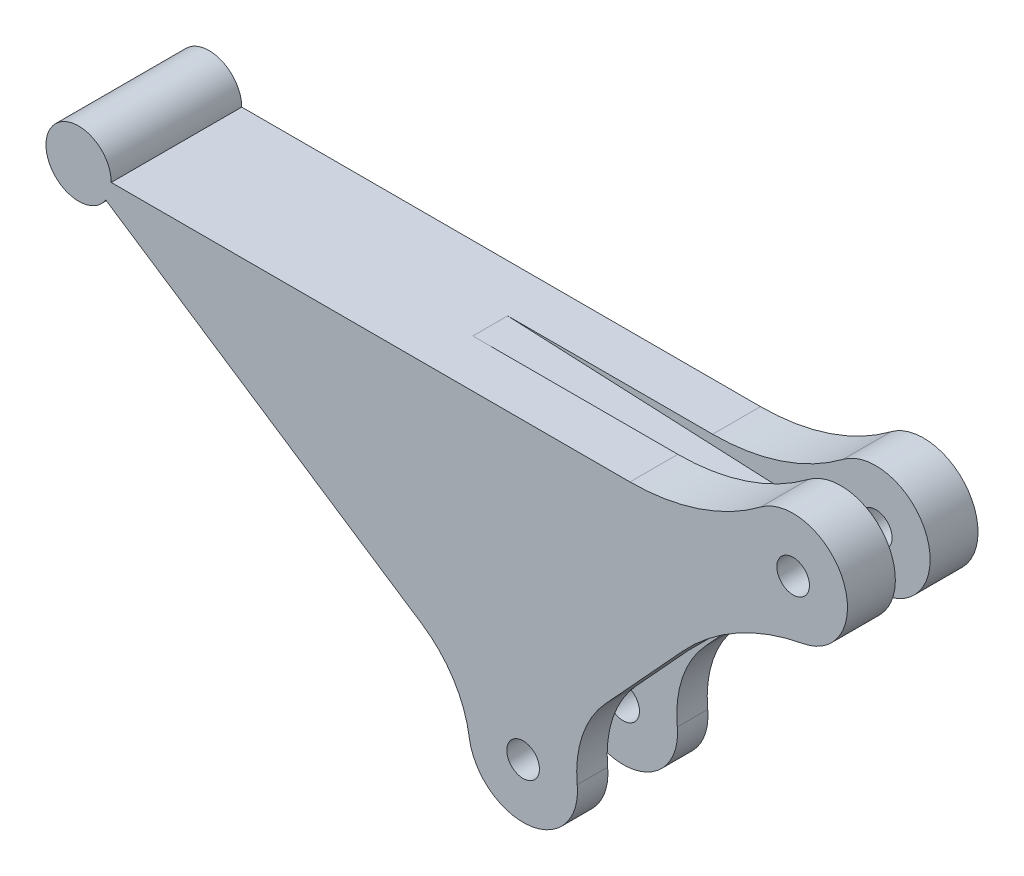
SolidWorks part; units mm, degrees
ref_plane "Plan de face" through (0, 0, 0) normal (0, 0, 1) x (1, 0, 0)
ref_plane "Plan de dessus" through (0, 0, 0) normal (0, 1, 0) x (1, 0, 0)
ref_plane "Plan de droite" through (0, 0, 0) normal (1, 0, 0) x (0, 0, -1)
sketch "Esquisse1" plane through (0, 0, 0) normal (0, 0, 1) x (1, 0, 0)
  line L0 (0, 0) -> (-65.7, 0)
  line L1 (0, 0) -> (-24.8279, -27.0272)
  line L2 (-24.8279, -27.0272) -> (-65.7, 0)
  circle A0 centre (0, 0) radius 1.5
  circle A1 centre (0, 0) radius 5
  circle A2 centre (-65.7, 0) radius 3
  circle A3 centre (0, 0) radius 36.7 construction
  circle A4 centre (-65.7, 0) radius 49 construction
  circle A5 centre (-24.8279, -27.0272) radius 5
  circle A6 centre (-24.8279, -27.0272) radius 1.5
  dimension "D1" = 3
  dimension "D2" = 10
  dimension "D4" = 6
  dimension "D5" = 73.4
  dimension "D6" = 98
  dimension "D7" = 10
  dimension "D8" = 3
  dimension "D3" = 65.7
extrude "Boss.-Extru.1" add sketch "Esquisse1" along normal blind 12 contours L0 A1 L1 A0 | L1 A1 L0 A0 | A6 L1 A5 L2 | A6 L2 A5 L1 | L0 A2 L2 | A5 L1 A1 L0 A2 L2 | L2 A2 L0
sketch3d "Esquisse3D1" plane through (0, 0, 0) normal (0, 0, 1) x (1, 0, 0)
  dimension "D1" = 6
sketch "Esquisse2" plane through (0, 0, 6) normal (0, 0, -1) x (-1, 0, 0)
  line L0 (0, 0) -> (46.0981, -12.962) construction
  line L1 (28.9985, -24.2693) -> (63.1976, -1.6547) construction
  line L2 (4.8133, -1.3534) -> (33.85, 0)
  line L3 (5, 0) -> (62.7, 0) construction
  line L4 (4.8133, -1.3534) -> (12.4139, -13.5136)
  line L5 (3.3825, -3.6822) -> (21.4453, -23.345) construction
  line L6 (12.4139, -13.5136) -> (3.3825, -3.6822)
  line L7 (5, 0) -> (33.85, 0)
  circle A0 centre (0, 0) radius 1.5
  arc A1 (5, 0) -> (3.3825, -3.6822) centre (0, 0) ccw
  dimension "D1" = 3
  dimension "D2" = 14.3401
extrude "Enlèv. mat.-Extru.1" cut sketch "Esquisse2" against normal blind 1.6 and the other way blind 1.6
sketch3d "Esquisse3D2" plane through (0, 0, 0) normal (0, 0, 1) x (1, 0, 0)
sketch "Esquisse3" plane through (0, 0, 6) normal (0, 0, -1) x (-1, 0, 0)
  line L0 (24.8279, -27.0272) -> (33.85, 0) construction
  line L1 (5, 0) -> (62.7, 0) construction
  line L2 (26.4111, -22.2844) -> (27.361, -19.4388)
  line L3 (27.361, -19.4388) -> (46.0981, -12.962)
  line L4 (28.9985, -24.2693) -> (63.1976, -1.6547) construction
  line L5 (27.361, -19.4388) -> (12.4139, -13.5136)
  line L6 (3.3825, -3.6822) -> (21.4453, -23.345) construction
  line L7 (12.4139, -13.5136) -> (21.4453, -23.345)
  line L8 (28.9985, -24.2693) -> (46.0981, -12.962)
  circle A0 centre (24.8279, -27.0272) radius 1.5
  arc A1 (21.4453, -23.345) -> (28.9985, -24.2693) centre (24.8279, -27.0272) ccw
  dimension "D1" = 3
  dimension "D2" = 19.8249
  dimension "D3" = 3
extrude "Enlèv. mat.-Extru.2" cut sketch "Esquisse3" against normal blind 3.2 and the other way blind 3.2 contours L5 L7 A1 L8 L3
fillet "Congé1" radius 20 4 edges at (-5, 0, 2.2) (-5, 0, 9.8) (-3.3825, -3.6822, 2.2) (-3.3825, -3.6822, 9.8)
fillet "Congé2" radius 10 4 edges at (-28.9985, -24.2693, 1.4) (-28.9985, -24.2693, 10.6) (-21.4453, -23.345, 1.4) (-21.4453, -23.345, 10.6)
